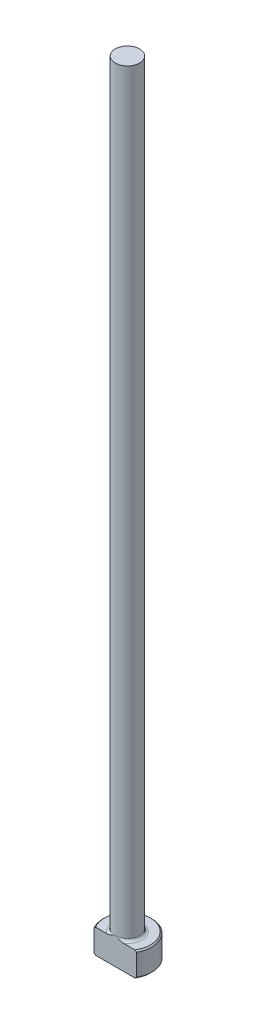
SolidWorks part; units mm, degrees
ref_plane "Front Plane" through (0, 0, 0) normal (0, 0, 1) x (1, 0, 0)
ref_plane "Top Plane" through (0, 0, 0) normal (0, 1, 0) x (1, 0, 0)
ref_plane "Right Plane" through (0, 0, 0) normal (1, 0, 0) x (0, 0, -1)
sketch "Sketch1" plane through (0, 0, 0) normal (0, 0, 1) x (1, 0, 0)
  line L0 (0, 259.9588) -> (0, -15.1925) construction
  line L1 (0, 0) -> (-4.7625, 0)
  line L2 (-4.7625, 0) -> (-4.7625, 4.7498)
  line L3 (-4.7625, 4.7498) -> (-2.3812, 4.7498)
  line L4 (-2.3812, 4.7498) -> (-2.3812, 152.4)
  line L5 (-2.3812, 152.4) -> (0, 152.4)
  line L6 (0, 152.4) -> (0, 0)
  dimension "L" = 152.4
  dimension "H" = 9.525
  dimension "T" = 4.7498
  dimension "D" = 4.7625
revolve "Revolve1" add sketch "Sketch1" angle 360 about L0
chamfer "Chamfer1" distance 0.254 angle 45 2 edges at (0, 4.7498, 4.7625) (0, 0, 4.7625)
fillet "Fillet1" radius 0.508 1 edges at (0, 4.7498, 2.3812)
sketch "Sketch2" plane through (0, 0, 0) normal (0, -1, 0) x (1, 0, 0)
  line L0 (-4.1244, 2.3812) -> (4.1244, 2.3812)
  arc A0 (4.1244, 2.3812) -> (-4.1244, 2.3812) centre (0, 0) ccw
  circle A1 centre (0, 0) radius 4.7625 construction
  circle A3 centre (0, 0) radius 2.3812 construction
extrude "KEY" cut sketch "Sketch2" against normal through all
sketch "Pocket Sketch" plane through (0, 0, 0) normal (0, 0, 1) x (1, 0, 0)
  line L0 (-5.1594, 0) -> (-5.1594, 4.7752)
  line L1 (-5.1594, 4.7752) -> (-3.3417, 4.7752)
  line L2 (-2.5797, 5.5372) -> (-2.5797, 22.225)
  line L3 (-2.5797, 22.225) -> (0, 22.225)
  line L4 (0, 22.225) -> (0, 0)
  line L5 (0, 0) -> (-5.1594, 0)
  line L6 (0, 12.6104) -> (0, -2.4989) construction
  line L7 (-4.7625, 4.4958) -> (-4.7625, 0.254) construction
  line L8 (4.5085, 4.7498) -> (-4.5085, 4.7498) construction
  line L9 (-2.3812, 152.4) -> (-2.3812, 5.2578) construction
  line L10 (-3.3417, 4.7752) -> (-2.5797, 5.5372)
  point P3 (-2.5797, 4.7752)
  dimension "D1" = 10.3187
  dimension "D2" = 0.3969
  dimension "D3" = 0.0254
  dimension "D4" = 0.1984
  dimension "D5" = 5.1594
  dimension "D6" = 22.225
